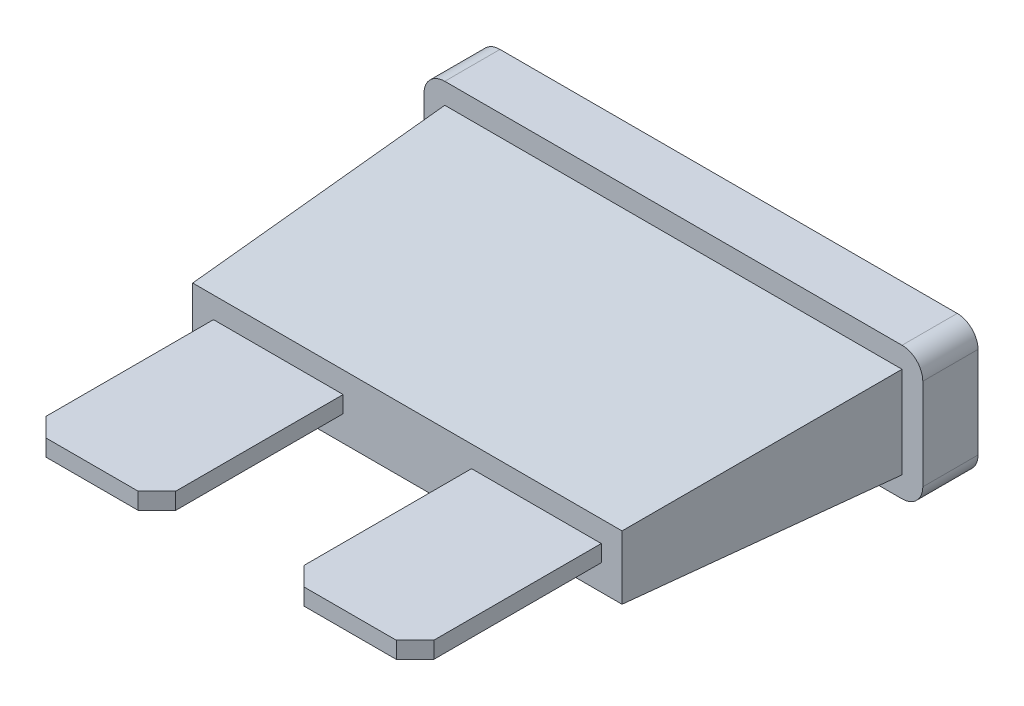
SolidWorks part; units mm, degrees
ref_plane "Front Plane" through (0, 0, 0) normal (0, 0, 1) x (1, 0, 0)
ref_plane "Top Plane" through (0, 0, 0) normal (0, 1, 0) x (1, 0, 0)
ref_plane "Right Plane" through (0, 0, 0) normal (1, 0, 0) x (0, 0, -1)
sketch "Sketch1" plane through (0, 0, 0) normal (0, 0, 1) x (1, 0, 0)
  line L0 (9.525, -2.54) -> (-9.525, 2.54) construction
  line L1 (-8.7312, 2.54) -> (8.7312, 2.54)
  line L2 (-9.525, 1.7462) -> (-9.525, -1.7462)
  line L3 (-8.7312, -2.54) -> (8.7312, -2.54)
  line L4 (9.525, 1.7462) -> (9.525, -1.7462)
  arc A0 (8.7312, 2.54) -> (9.525, 1.7462) centre (8.7312, 1.7462) cw
  arc A1 (8.7312, -2.54) -> (9.525, -1.7462) centre (8.7312, -1.7463) ccw
  arc A2 (-9.525, -1.7462) -> (-8.7312, -2.54) centre (-8.7313, -1.7463) ccw
  arc A3 (-8.7312, 2.54) -> (-9.525, 1.7462) centre (-8.7313, 1.7462) ccw
  point P11 (-9.525, -2.54)
  dimension "D3" = 0.7937
  dimension "D1" = 5.08
  dimension "D2" = 19.05
extrude "Extrude1" add sketch "Sketch1" along normal blind 2.1082
sketch "Sketch2" plane through (0, 0, 2.1082) normal (0, 0, 1) x (1, 0, 0)
  line L8 (8.7312, -1.7463) -> (8.7312, 1.7462)
  line L9 (-8.7313, -1.7463) -> (8.7312, -1.7463)
  line L10 (-8.7313, 1.7462) -> (-8.7313, -1.7463)
  line L11 (8.7312, 1.7462) -> (-8.7313, 1.7462)
  line L12 (8.7312, -1.7463) -> (8.7312, 1.7462)
  line L13 (-8.7313, -1.7463) -> (8.7312, -1.7463)
  line L14 (-8.7313, 1.7462) -> (-8.7313, -1.7463)
  line L15 (8.7312, 1.7462) -> (-8.7313, 1.7462)
  dimension "D1" = 0.7937
extrude "Extrude2" add sketch "Sketch2" along normal blind 10.16 draft 3
sketch "Sketch3" plane through (0, 0, 12.2682) normal (0, 0, 1) x (1, 0, 0)
  line L0 (-8.1988, 1.2138) -> (-8.1988, -1.2138) construction
  line L1 (-7.405, 0.3994) -> (-2.452, 0.3994)
  line L2 (-7.405, 0.3994) -> (-7.405, -0.2356)
  line L3 (-7.405, -0.2356) -> (-2.452, -0.2356)
  line L4 (-2.452, 0.3994) -> (-2.452, -0.2356)
  line L5 (2.452, 0.3994) -> (7.405, 0.3994)
  line L6 (2.452, 0.3994) -> (2.452, -0.2356)
  line L7 (2.452, -0.2356) -> (7.405, -0.2356)
  line L8 (7.405, 0.3994) -> (7.405, -0.2356)
  line L9 (8.1988, -1.2138) -> (8.1988, 1.2138) construction
  point P10 (8.1988, 0)
  dimension "D1" = 4.953
  dimension "D2" = 0.635
  dimension "D3" = 0.7937
  dimension "D4" = 0.7937
extrude "Extrude3" add sketch "Sketch3" along normal blind 7.112
sketch "Sketch4" plane through (0, 0, 0) normal (0, 0, -1) x (-1, 0, 0)
  line L0 (-1.5207, 1.4439) -> (-1.5207, -1.3517)
  line L1 (-1.5207, -1.3517) -> (-1.7184, -1.3517)
  line L2 (-1.7184, -1.3517) -> (-1.7184, -1.6199)
  line L3 (-1.7184, -1.6199) -> (-0.8098, -1.6199)
  line L4 (-0.8098, -1.6199) -> (-0.8098, -1.3517)
  line L5 (-0.8098, -1.3517) -> (-1.0098, -1.3517)
  line L6 (-1.0098, -1.3517) -> (-1.0098, 1.8814)
  line L7 (-1.0098, 1.8814) -> (-1.2641, 1.8814)
  line L8 (-1.2641, 1.8814) -> (-1.7184, 1.427)
  line L9 (-1.7184, 1.427) -> (-1.5207, 1.4439)
  line L11 (1.1192, 1.8814) -> (1.6667, 1.8814)
  line L12 (0.3255, 1.0876) -> (0.3255, -0.8262)
  line L13 (1.1192, -1.6199) -> (1.6667, -1.6199)
  line L14 (2.4604, 1.0876) -> (2.4604, -0.8262)
  line L15 (1.1772, 1.4439) -> (1.623, 1.4439)
  line L16 (0.7809, 1.0476) -> (0.7809, -0.7923)
  line L17 (1.1772, -1.1886) -> (1.623, -1.1886)
  line L18 (2.0192, 1.0476) -> (2.0192, -0.7923)
  arc A0 (1.6667, 1.8814) -> (2.4604, 1.0876) centre (1.6667, 1.0876) cw
  arc A1 (0.3255, 1.0876) -> (1.1192, 1.8814) centre (1.1192, 1.0876) cw
  arc A2 (1.1192, -1.6199) -> (0.3255, -0.8262) centre (1.1192, -0.8262) cw
  arc A3 (2.4604, -0.8262) -> (1.6667, -1.6199) centre (1.6667, -0.8262) cw
  arc A4 (1.1772, 1.4439) -> (0.7809, 1.0476) centre (1.1772, 1.0476) ccw
  arc A5 (1.623, 1.4439) -> (2.0192, 1.0476) centre (1.623, 1.0476) cw
  arc A6 (1.623, -1.1886) -> (2.0192, -0.7923) centre (1.623, -0.7923) ccw
  arc A7 (1.1772, -1.1886) -> (0.7809, -0.7923) centre (1.1772, -0.7923) cw
  dimension "D1" = 0.7937
  dimension "D2" = 0.3962
extrude "10" cut sketch "Sketch4" against normal blind 0.381
sketch "Sketch5" plane through (0, 0.3994, 0) normal (0, 1, 0) x (-1, 0, 0)
  line L0 (-7.405, 18.6644) -> (-6.6892, 19.3802)
  line L1 (-7.405, 19.3802) -> (-7.405, 12.2682) construction
  line L2 (-7.405, 19.3802) -> (-2.452, 19.3802) construction
  line L3 (-6.6892, 19.3802) -> (-7.405, 19.3802)
  line L4 (-7.405, 19.3802) -> (-7.405, 18.6644)
  line L5 (-2.452, 18.6644) -> (-3.1678, 19.3802)
  line L6 (-2.452, 19.3802) -> (-2.452, 12.2682) construction
  line L7 (-3.1678, 19.3802) -> (-2.452, 19.3802)
  line L8 (-2.452, 19.3802) -> (-2.452, 18.6644)
  line L9 (2.452, 18.6644) -> (3.1678, 19.3802)
  line L10 (2.452, 19.3802) -> (2.452, 12.2682) construction
  line L11 (2.452, 19.3802) -> (7.405, 19.3802) construction
  line L12 (3.1678, 19.3802) -> (2.452, 19.3802)
  line L13 (2.452, 19.3802) -> (2.452, 18.6644)
  line L14 (7.405, 18.6644) -> (6.6892, 19.3802)
  line L15 (7.405, 19.3802) -> (7.405, 12.2682) construction
  line L16 (6.6892, 19.3802) -> (7.405, 19.3802)
  line L17 (7.405, 19.3802) -> (7.405, 18.6644)
extrude "Cut-Extrude2" cut sketch "Sketch5" against normal through all
sketch "Sketch6" plane through (0, 0.3994, 0) normal (0, 1, 0) x (-1, 0, 0)
  line L0 (-8.1988, 12.2682) -> (8.1988, 12.2682) construction
  line L1 (-6.4441, 12.2682) -> (-3.413, 12.2682)
  line L2 (-6.4441, 12.2682) -> (-6.4441, 8.458)
  line L3 (-6.4441, 8.458) -> (-3.7959, 8.458)
  line L4 (-3.413, 12.2682) -> (-3.413, 9.6746)
  line L5 (2.452, 12.2682) -> (7.405, 12.2682) construction
  line L6 (3.413, 12.2682) -> (6.4441, 12.2682)
  line L7 (3.413, 12.2682) -> (3.413, 9.6746)
  line L8 (3.7959, 8.458) -> (6.4441, 8.458)
  line L9 (6.4441, 12.2682) -> (6.4441, 8.458)
  line L10 (-4.9285, 19.3802) -> (-4.9285, 12.2682) construction
  line L11 (-6.6892, 19.3802) -> (-3.1678, 19.3802) construction
  line L12 (4.9285, 19.3802) -> (4.9285, 12.2682) construction
  line L13 (3.1678, 19.3802) -> (6.6892, 19.3802) construction
  arc A0 (-3.413, 9.6746) -> (-1.4475, 6.787) centre (-4.5514, 6.787) cw
  arc A1 (-1.4475, 6.787) -> (1.4475, 6.787) centre (0, 6.787) ccw
  arc A2 (1.4475, 6.787) -> (3.413, 9.6746) centre (4.5514, 6.787) cw
  arc A3 (-3.7959, 8.458) -> (-2.7175, 6.787) centre (-4.5514, 6.787) cw
  arc A4 (-2.7175, 6.787) -> (2.7175, 6.787) centre (0, 6.787) ccw
  arc A5 (2.7175, 6.787) -> (3.7959, 8.458) centre (4.5514, 6.787) cw
  arc A6 (2.7175, 6.787) -> (3.8788, 8.4931) centre (4.5514, 6.787) cw construction
  arc A7 (-3.8788, 8.4931) -> (-2.7175, 6.787) centre (-4.5514, 6.787) cw construction
  dimension "D1" = 1.27
extrude "Extrude4" add sketch "Sketch6" against normal up to surface (0.635 mm away) separate body
